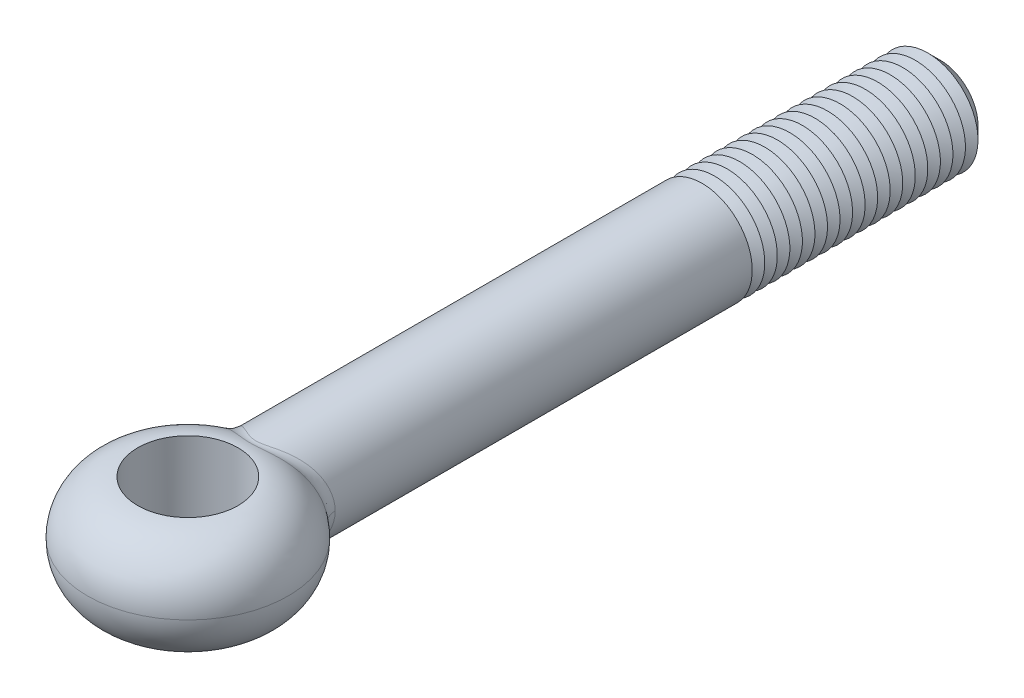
SolidWorks part; units mm, degrees
ref_plane "Front Plane" through (0, 0, 0) normal (0, 0, 1) x (1, 0, 0)
ref_plane "Top Plane" through (0, 0, 0) normal (0, 1, 0) x (1, 0, 0)
ref_plane "Right Plane" through (0, 0, 0) normal (1, 0, 0) x (0, 0, -1)
sketch "Sketch7" plane through (0, 0, 0) normal (0, 1, 0) x (1, 0, 0)
  circle A0 centre (0, 0) radius 16
  dimension "D1" = 32
extrude "Boss-Extrude3" add sketch "Sketch7" along normal mid plane 17
sketch "Sketch8" plane through (0, 0, 0) normal (0, 0, 1) x (1, 0, 0)
  circle A0 centre (0, 0) radius 8
  dimension "D1" = 16
extrude "Boss-Extrude4" add sketch "Sketch8" against normal blind 120
fillet "Fillet5" radius 8.5 2 edges at (0, -8.5, 16) (0, 8.5, 16)
fillet "Fillet6" radius 3 2 edges at (-0.1803, -7.998, -10.3764) (0.1803, 7.998, -10.3764)
chamfer "Chamfer1" distance 2 angle 45 1 edges at (8, 0, -120)
sketch "Sketch10" plane through (0, 0, 0) normal (0, 1, 0) x (1, 0, 0)
  line L0 (0, 28.1405) -> (0, -7.9233) construction
sketch "Sketch11" plane through (0, 0, 0) normal (0, 1, 0) x (1, 0, 0)
  line L0 (-8, 82) -> (-6.2679, 83)
  line L1 (-8, 118) -> (-8, 15.4919) construction
  line L2 (-6.2679, 83) -> (-8, 84)
  line L3 (-8, 84) -> (-8, 82)
  line L4 (6, 120) -> (-6, 120) construction
  dimension "D1" = 2
  dimension "D2" = 38
revolve "Cut-Revolve1" cut sketch "Sketch11" angle 360 about L0
pattern_linear "LPattern1" count 18 spacing 2 along (0, 0, -1) of "Cut-Revolve1"
sketch "Sketch12" plane through (0, 0, 0) normal (0, 1, 0) x (1, 0, 0)
  circle A0 centre (0, 0) radius 8
  dimension "D1" = 16
extrude "Cut-Extrude1" cut sketch "Sketch12" against normal mid plane 17
